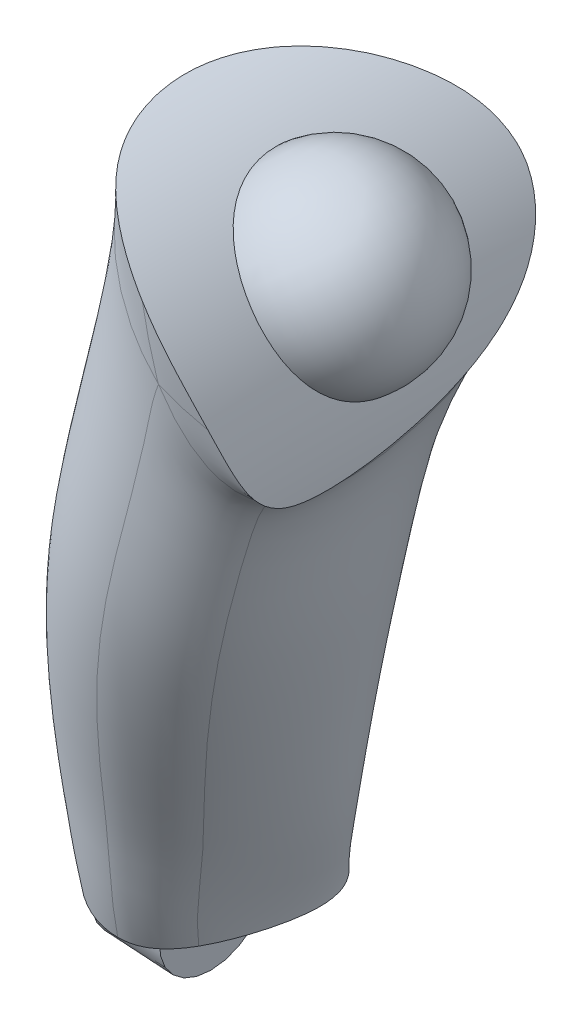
SolidWorks part; units mm, degrees
ref_plane "Front Plane" through (0, 0, 0) normal (0, 0, 1) x (1, 0, 0)
ref_plane "Top Plane" through (0, 0, 0) normal (0, 1, 0) x (1, 0, 0)
ref_plane "Right Plane" through (0, 0, 0) normal (1, 0, 0) x (0, 0, -1)
imported_body "Stock-Source-1"
ref_plane "Plane1" through (0, 0, 88.9) normal (0, 0, 1) x (1, 0, 0)
sketch "Sketch1" plane through (0, 0, 88.9) normal (0, 0, 1) x (1, 0, 0)
  line L0 (-91.1319, 3691.0767) -> (-15.4399, 3593.5407)
  line L1 (-91.1319, 3691.0767) -> (-91.1319, 3593.5407) construction
  line L2 (-91.1319, 3593.5407) -> (-15.4399, 3593.5407) construction
  line L3 (-15.4399, 3593.5407) -> (-17.8008, 3594.7212) construction
  arc A0 (-65.8944, 3673.3493) -> (-119.2964, 3703.6445) centre (-170.2519, 3551.6103) ccw construction
  arc A1 (-15.4399, 3593.5407) -> (-91.1319, 3691.0767) centre (-53.2859, 3642.3087) ccw
  dimension "D1" = 97.536
  dimension "D2" = 75.692
revolve "Revolve1" add sketch "Sketch1" angle 360 about L0
sketch "Sketch2" plane through (0, 0, 88.9) normal (0, 0, 1) x (1, 0, 0)
  line L0 (-174.2834, 3251.4153) -> (-130.655, 3248.6138)
  line L1 (-174.2834, 3251.4153) -> (-176.5214, 3216.5621)
  line L2 (-130.655, 3248.6138) -> (-132.8931, 3213.7605)
  line L3 (-176.5214, 3216.5621) -> (-132.8931, 3213.7605)
  line L4 (-203.468, 3253.2894) -> (-145.0987, 3249.5413) construction
  line L5 (-145.0987, 3249.5413) -> (-116.2113, 3247.6863) construction
  dimension "D1" = 34.925
revolve "Revolve2" add sketch "Sketch2" angle 360 about L0
